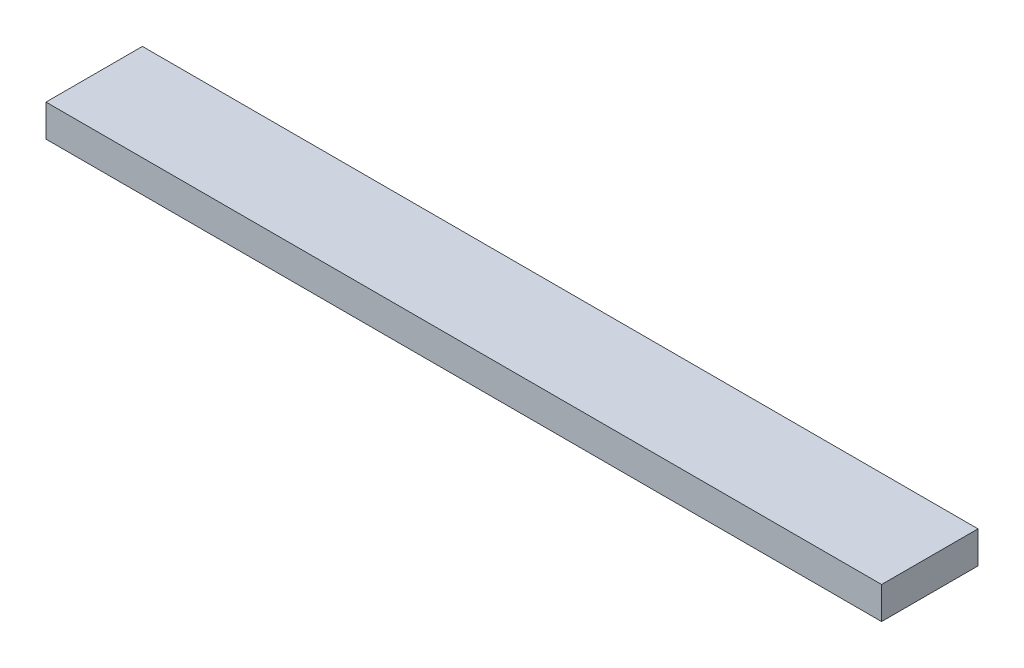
SolidWorks part; units mm, degrees
ref_plane "Front Plane" through (0, 0, 0) normal (0, 0, 1) x (1, 0, 0)
ref_plane "Top Plane" through (0, 0, 0) normal (0, 1, 0) x (1, 0, 0)
ref_plane "Right Plane" through (0, 0, 0) normal (1, 0, 0) x (0, 0, -1)
sketch "Sketch1" plane through (0, 0, 0) normal (0, 1, 0) x (1, 0, 0)
  line L1 (0, 0) -> (82.55, 0)
  line L2 (0, 0) -> (0, 9.525)
  line L3 (0, 9.525) -> (82.55, 9.525)
  line L4 (82.55, 0) -> (82.55, 9.525)
  dimension "D1" = 82.55
  dimension "D2" = 9.525
extrude "Popsicle stick 1" add sketch "Sketch1" along normal blind 3.175
